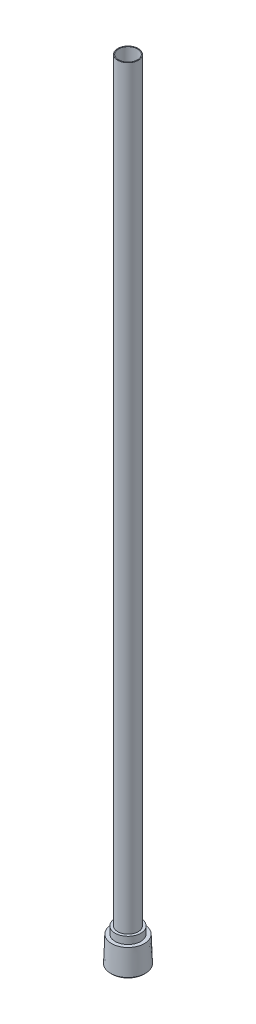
SolidWorks part; units mm, degrees
ref_plane "Front Plane" through (0, 0, 0) normal (0, 0, 1) x (1, 0, 0)
ref_plane "Top Plane" through (0, 0, 0) normal (0, 1, 0) x (1, 0, 0)
ref_plane "Right Plane" through (0, 0, 0) normal (1, 0, 0) x (0, 0, -1)
sketch "Sketch1" plane through (0, 0, 0) normal (1, 0, 0) x (0, 0, -1)
  line L0 (0, 304.8) -> (0, 0)
  line L1 (4.953, 10.3124) -> (4.953, 13.081)
  line L2 (4.953, 13.081) -> (3.9624, 13.081)
  line L5 (6.7183, 0) -> (6.3423, 10.3124)
  line L6 (0, 0) -> (6.7183, 0)
  line L7 (6.3423, 10.3124) -> (4.953, 10.3124)
  line L8 (3.9624, 13.081) -> (3.9624, 304.8)
  line L9 (3.9624, 304.8) -> (0, 304.8)
  line L10 (0, 0) -> (0, -49989.3417) construction
  dimension "D1" = 2.088
  dimension "PH" = 10.3124
  dimension "L" = 304.8
  dimension "OD" = 7.9248
  dimension "NPT" = 13.4366
  dimension "SH-D" = 9.906
  dimension "SH" = 13.081
revolve "Revolve1" add sketch "Sketch1" angle 360 about L10
sketch "Sketch3" plane through (0, 0, 0) normal (0, -1, 0) x (-1, 0, 0)
  line L0 (0, 7.3705) -> (0, -7.3705) construction
  line L1 (0, -3.6662) -> (3.175, -1.8331)
  line L2 (3.175, -1.8331) -> (3.175, 1.8331)
  line L3 (3.175, 1.8331) -> (0, 3.6662)
  line L4 (0, 3.6662) -> (-3.175, 1.8331)
  line L5 (-3.175, 1.8331) -> (-3.175, -1.8331)
  line L6 (-3.175, -1.8331) -> (0, -3.6662)
  circle A0 centre (0, 0) radius 3.175 construction
  dimension "HEX" = 6.35
extrude "Cut-Extrude2" cut sketch "Sketch3" against normal blind 7.9248
sketch "Sketch2" plane through (0, 304.8, 0) normal (0, 1, 0) x (1, 0, 0)
  circle A0 centre (0, 0) radius 3.6576
  dimension "ID" = 7.3152
extrude "Cut-Extrude1" cut sketch "Sketch2" against normal up to surface (296.8752 mm away)
chamfer "Chamfer1" distance 0.508 angle 45 1 edges at (0, 0, 6.7183)
